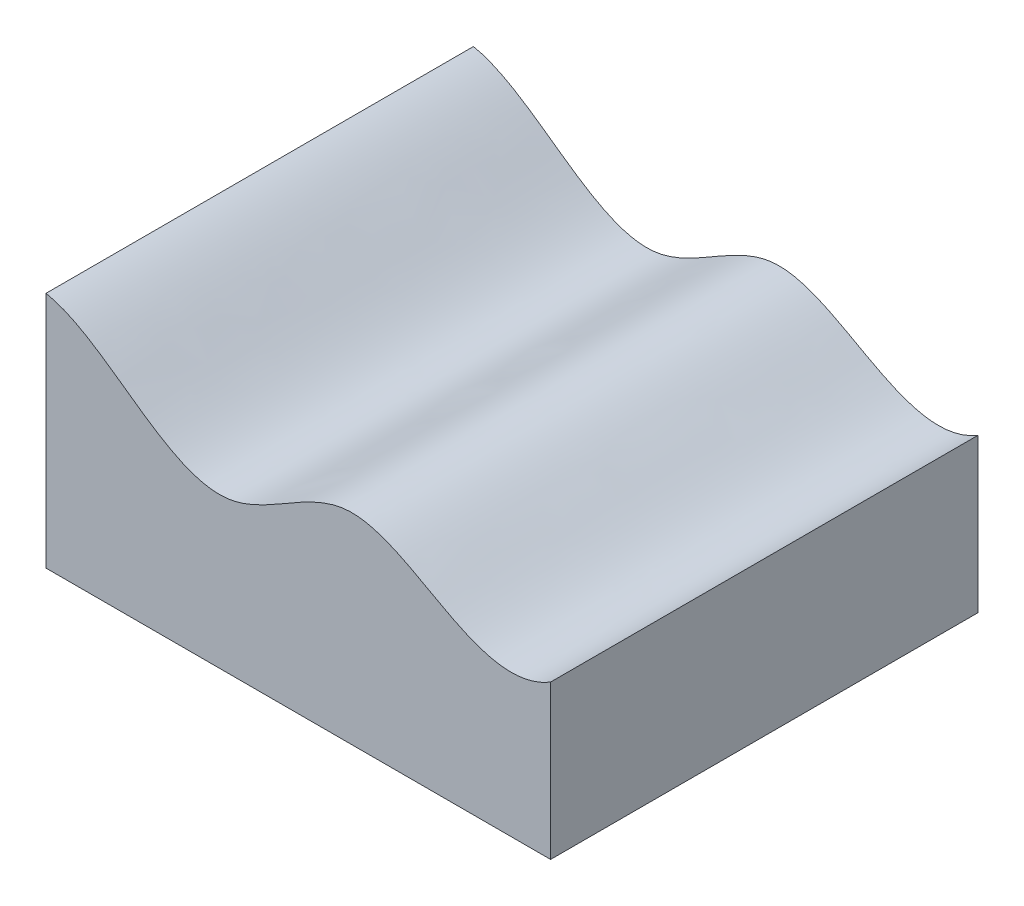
SolidWorks part; units mm, degrees
ref_plane "Front Plane" through (0, 0, 0) normal (0, 0, 1) x (1, 0, 0)
ref_plane "Top Plane" through (0, 0, 0) normal (0, 1, 0) x (1, 0, 0)
ref_plane "Right Plane" through (0, 0, 0) normal (1, 0, 0) x (0, 0, -1)
sketch "Sketch1" plane through (0, 0, 0) normal (0, 1, 0) x (1, 0, 0)
  line L1 (-94.7449, -80.2493) -> (94.7449, -80.2493)
  line L2 (-94.7449, -80.2493) -> (-94.7449, 80.2493)
  line L3 (-94.7449, 80.2493) -> (94.7449, 80.2493)
  line L4 (94.7449, -80.2493) -> (94.7449, 80.2493)
  line L5 (-94.7449, -80.2493) -> (94.7449, 80.2493) construction
  line L6 (-94.7449, 80.2493) -> (94.7449, -80.2493) construction
  point P0 (0, 0)
extrude "Boss-Extrude1" add sketch "Sketch1" along normal blind 40.132
sketch "Sketch2" plane through (0, 0, 0) normal (0, 0, 1) x (1, 0, 0)
  spline S0 degree 3 poles (-135.1078, 54.2524) (-99.3907, 135.3658) (-49.7777, 19.4804) (31.2479, 103.2732) (74.6916, 30.0451) (106.4486, 68.1726) knots 0 0 0 0 0.466698 0.647731 1 1 1 1
surface "Surface-Extrude1" sketch "Sketch2" parameters "D1"=203.2
other "Replace Face1"
